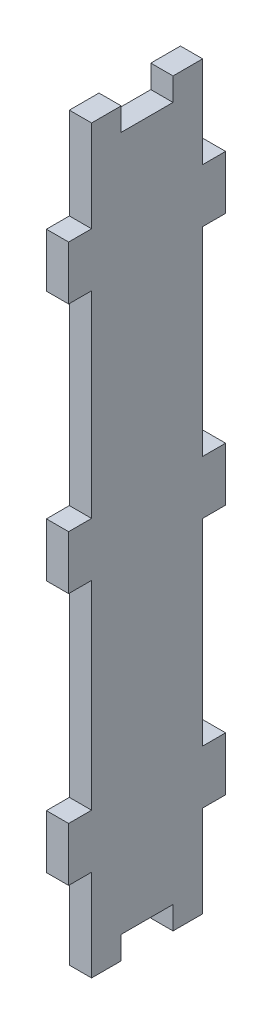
SolidWorks part; units mm, degrees
ref_plane "Front Plane" through (0, 0, 0) normal (0, 0, 1) x (1, 0, 0)
ref_plane "Top Plane" through (0, 0, 0) normal (0, 1, 0) x (1, 0, 0)
ref_plane "Right Plane" through (0, 0, 0) normal (1, 0, 0) x (0, 0, -1)
sketch "Sketch1" plane through (0, 0, 0) normal (1, 0, 0) x (0, 0, -1)
  line L0 (-15, 100) -> (15, -100) construction
  line L1 (-15, 100) -> (15, 100)
  line L2 (-15, 100) -> (-15, -100)
  line L3 (-15, -100) -> (15, -100)
  line L4 (15, 100) -> (15, -100)
  point P4 (0, 0)
  dimension "D1" = 200
  dimension "D2" = 30
extrude "Boss-Extrude1" add sketch "Sketch1" along normal blind 6
sketch "Sketch2" plane through (6, 0, 0) normal (1, 0, 0) x (0, 0, -1)
  line L0 (15, 100) -> (-15, 100) construction
  line L1 (-15, 100) -> (-15, -100) construction
  line L2 (15, -100) -> (15, 100) construction
  line L3 (-15, -100) -> (15, -100) construction
  line B0 (-15, 60.75) -> (-15, 75.25)
  line B1 (-15, 75.25) -> (-21.2, 75.25)
  line B2 (-21.2, 75.25) -> (-21.2, 60.75)
  line B3 (-21.2, 60.75) -> (-15, 60.75)
  line B4 (-21.2, 68) -> (-15, 68) construction
  line B5 (-15, -7) -> (-15, 7.5)
  line B6 (-15, 7.5) -> (-21.2, 7.5)
  line B7 (-21.2, 7.5) -> (-21.2, -7)
  line B8 (-21.2, -7) -> (-15, -7)
  line B9 (-15, -75.25) -> (-15, -60.75)
  line B10 (-15, -60.75) -> (-21.2, -60.75)
  line B11 (-21.2, -60.75) -> (-21.2, -75.25)
  line B12 (-21.2, -75.25) -> (-15, -75.25)
  line B13 (-21.2, -68) -> (-15, -68) construction
  line B14 (15, -60.75) -> (15, -75.25)
  line B15 (15, -75.25) -> (21.2, -75.25)
  line B16 (21.2, -75.25) -> (21.2, -60.75)
  line B17 (21.2, -60.75) -> (15, -60.75)
  line B18 (21.2, -68) -> (15, -68) construction
  line B19 (15, 7) -> (15, -7.5)
  line B20 (15, -7.5) -> (21.2, -7.5)
  line B21 (21.2, -7.5) -> (21.2, 7)
  line B22 (21.2, 7) -> (15, 7)
  line B23 (15, 75.25) -> (15, 60.75)
  line B24 (15, 60.75) -> (21.2, 60.75)
  line B25 (21.2, 60.75) -> (21.2, 75.25)
  line B26 (21.2, 75.25) -> (15, 75.25)
  line B27 (21.2, 68) -> (15, 68) construction
  dimension "D1" = 32
  dimension "D2" = 32
  dimension "D3" = 32
  dimension "D4" = 32
sketch_block_instance "Block-laser-cut-slot-15x6-3"
sketch_block "Block-laser-cut-slot-15x6" parameters "D1"=14.5, "D2"=6.2
sketch_block_instance "Block-laser-cut-slot-15x6-4"
sketch_block_instance "Block-laser-cut-slot-15x6-5"
sketch_block_instance "Block-laser-cut-slot-15x6-6"
sketch_block_instance "Block-laser-cut-slot-15x6-7"
sketch_block_instance "Block-laser-cut-slot-15x6-8"
extrude "Boss-Extrude2" add sketch "Sketch2" against normal blind 6
sketch "Sketch3" plane through (6, 0, 0) normal (1, 0, 0) x (0, 0, -1)
  line L0 (0, 100) -> (0, -100) construction
  line L1 (15, 100) -> (-15, 100) construction
  line L2 (-15, -100) -> (15, -100) construction
  line L4 (-7, 100) -> (7, 100)
  line L5 (-7, 100) -> (-7, 93.8)
  line L6 (-7, 93.8) -> (7, 93.8)
  line L7 (7, 100) -> (7, 93.8)
  line L8 (21.2, -7.5) -> (21.2, 7) construction
  line L9 (21.2, -0.25) -> (-21.2, -0.25) construction
  line L11 (-7, -93.8) -> (7, -93.8)
  line L12 (7, -100) -> (7, -93.8)
  line L13 (-7, -100) -> (7, -100)
  line L14 (-7, -100) -> (-7, -93.8)
  point P10 (-46.2292, -6.63)
  dimension "D1" = 14
  dimension "D2" = 6.2
extrude "Cut-Extrude1" cut sketch "Sketch3" against normal blind 6
